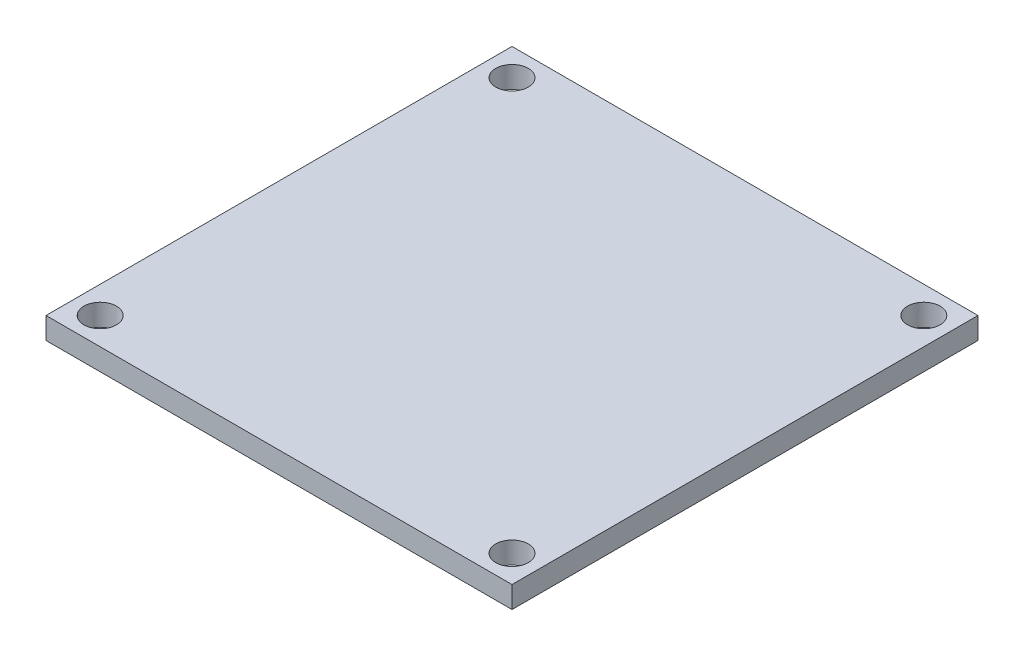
SolidWorks part; units mm, degrees
ref_plane "Front Plane" through (0, 0, 0) normal (0, 0, 1) x (1, 0, 0)
ref_plane "Top Plane" through (0, 0, 0) normal (0, 1, 0) x (1, 0, 0)
ref_plane "Right Plane" through (0, 0, 0) normal (1, 0, 0) x (0, 0, -1)
sketch "Sketch1" plane through (0, 0, 0) normal (0, 1, 0) x (1, 0, 0)
  line L1 (-21.5, -21.5) -> (21.5, -21.5)
  line L2 (-21.5, -21.5) -> (-21.5, 21.5)
  line L3 (-21.5, 21.5) -> (21.5, 21.5)
  line L4 (21.5, -21.5) -> (21.5, 21.5)
  line L5 (-21.5, -21.5) -> (21.5, 21.5) construction
  line L6 (-21.5, 21.5) -> (21.5, -21.5) construction
  point P0 (0, 0)
  dimension "D1" = 43
extrude "Boss-Extrude1" add sketch "Sketch1" along normal blind 2
sketch "Sketch2" plane through (0, 2, 0) normal (0, 1, 0) x (1, 0, 0)
  line L0 (-19, 19) -> (-19, -19) construction
  line L1 (-19, -19) -> (19, -19) construction
  line L2 (19, -19) -> (19, 19) construction
  line L3 (19, 19) -> (-19, 19) construction
  line L4 (-19, 19) -> (19, -19) construction
  circle A0 centre (-19, 19) radius 1.5
  circle A1 centre (19, 19) radius 1.5
  circle A2 centre (-19, -19) radius 1.5
  circle A3 centre (19, -19) radius 1.5
  dimension "D1" = 3
  dimension "D2" = 38
  dimension "D3" = 38
extrude "Cut-Extrude1" cut sketch "Sketch2" against normal blind 2
